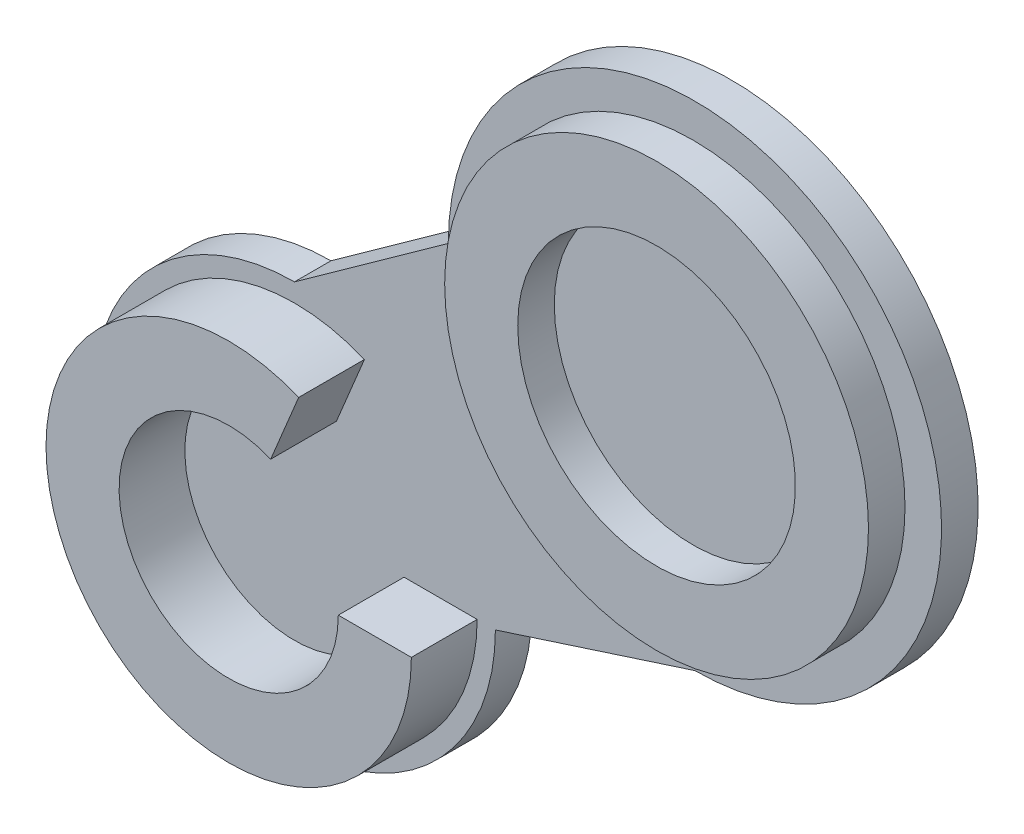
SolidWorks part; units mm, degrees
ref_plane "Plan de face" through (0, 0, 0) normal (0, 0, 1) x (1, 0, 0)
ref_plane "Plan de dessus" through (0, 0, 0) normal (0, 1, 0) x (1, 0, 0)
ref_plane "Plan de droite" through (0, 0, 0) normal (1, 0, 0) x (0, 0, -1)
sketch "Esquisse1" plane through (0, 0, 0) normal (0, 0, 1) x (1, 0, 0)
  line L2 (1.1492, 2.7712) -> (1.9153, 4.6186)
  line L3 (3, 0) -> (5, 0)
  arc A0 (1.1492, 2.7712) -> (3, 0) centre (0, 0) ccw
  arc A2 (1.9153, 4.6186) -> (5, 0) centre (0, 0) ccw
  dimension "D1" = 3
  dimension "D3" = 2
extrude "Boss.-Extru.1" add sketch "Esquisse1" along normal blind 1.8
ref_plane "Plan1" through (0, 0, 0) normal (0, 0, -1) x (-1, 0, 0)
sketch "Esquisse2" plane through (0, 0, 0) normal (0, 0, -1) x (-1, 0, 0)
  line L1 (-10.961, 1.7656) -> (-5.5, 0)
  line L5 (-4.211, 8.5156) -> (0, 5.5)
  circle A3 centre (-10.961, 8.5156) radius 5.75 construction
  arc A4 (-4.211, 8.5156) -> (-10.961, 1.7656) centre (-10.961, 8.5156) ccw
  arc A5 (-5.5, 0) -> (0, 5.5) centre (0, 0) ccw
  circle A6 centre (-10.961, 8.5156) radius 3.75 construction
  dimension "D1" = 2
  dimension "D5" = 7.5
  dimension "D4" = 1
extrude "Boss.-Extru.2" add sketch "Esquisse2" along normal blind 1
sketch "Esquisse4" plane through (0, 0, 0) normal (0, 0, -1) x (-1, 0, 0)
  circle A2 centre (-10.911, 8.5156) radius 3.8
  circle A3 centre (-10.911, 8.5156) radius 5.8
  dimension "D2" = 2
  dimension "D3" = 7.6
extrude "Boss.-Extru.3" add sketch "Esquisse4" against normal blind 1
